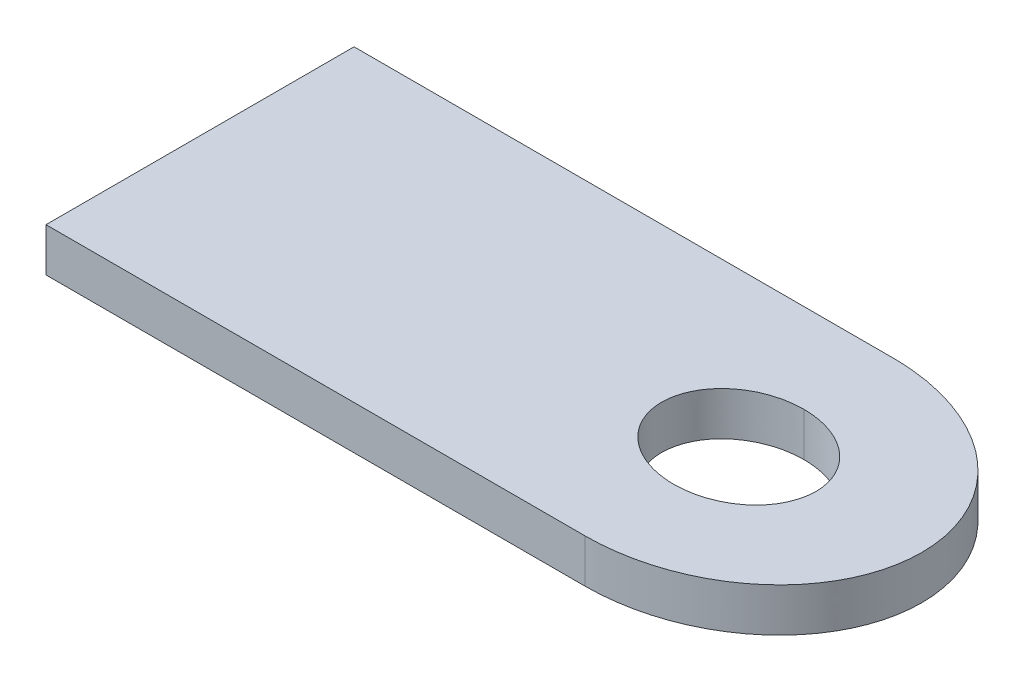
SolidWorks part; units mm, degrees
ref_plane "Front Plane" through (0, 0, 0) normal (0, 0, 1) x (1, 0, 0)
ref_plane "Top Plane" through (0, 0, 0) normal (0, 1, 0) x (1, 0, 0)
ref_plane "Right Plane" through (0, 0, 0) normal (1, 0, 0) x (0, 0, -1)
sketch "Sketch1" plane through (0, 0, 0) normal (0, 1, 0) x (1, 0, 0)
  line L1 (-42.8701, -34.0541) -> (61.1936, -34.0541)
  line L2 (-42.8701, -34.0541) -> (-42.8701, 36.647)
  line L3 (-42.8701, 36.647) -> (61.1936, 36.647)
  arc A0 (61.1936, -34.0541) -> (61.1936, 36.647) centre (61.1936, 1.2965) ccw
  circle A1 centre (61.1936, 1.2965) radius 14.9227
extrude "Extrude1" add sketch "Sketch1" along normal blind 10
other "Flex1" parameters "D0"=26.4052, "D1"=0, "D2"=0.9048
